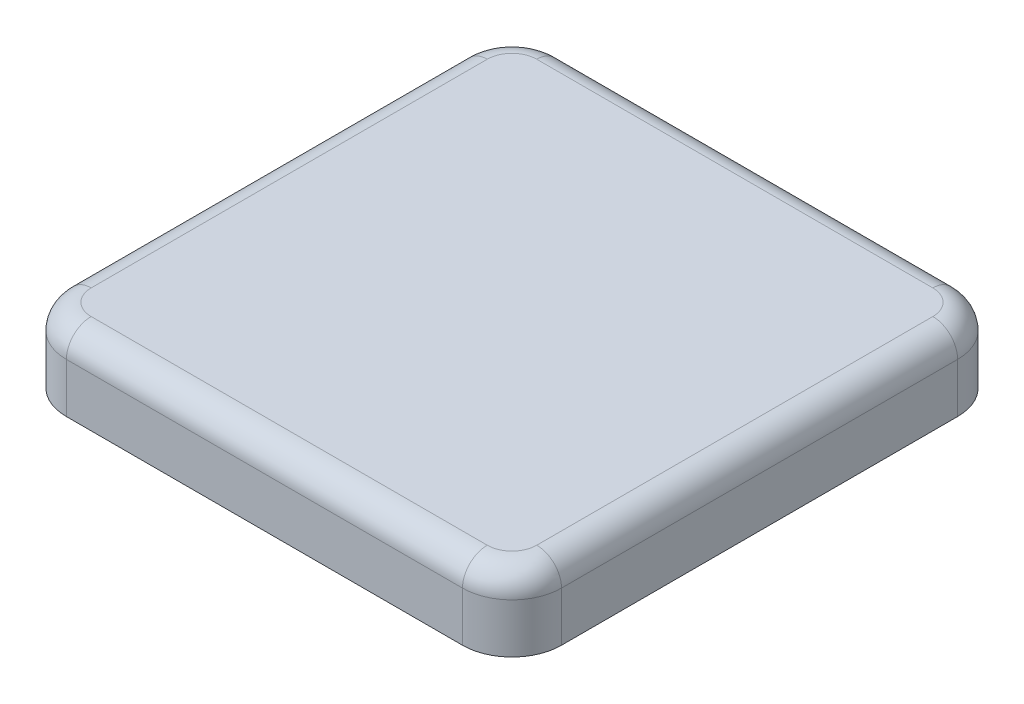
SolidWorks part; units mm, degrees
ref_plane "正面" through (0, 0, 0) normal (0, 0, 1) x (1, 0, 0)
ref_plane "平面" through (0, 0, 0) normal (0, 1, 0) x (1, 0, 0)
ref_plane "右側面" through (0, 0, 0) normal (1, 0, 0) x (0, 0, -1)
sketch "ｽｹｯﾁ1" plane through (0, 0, 0) normal (0, 1, 0) x (0, 0, -1)
  line L1 (-8, 10) -> (8, 10)
  line L2 (-10, 8) -> (-10, -8)
  line L3 (-8, -10) -> (8, -10)
  line L4 (10, 8) -> (10, -8)
  arc A0 (10, 8) -> (8, 10) centre (8, 8) ccw
  arc A1 (8, -10) -> (10, -8) centre (8, -8) ccw
  arc A2 (-10, -8) -> (-8, -10) centre (-8, -8) ccw
  arc A3 (-8, 10) -> (-10, 8) centre (-8, 8) ccw
  point P7 (10, 10)
  point P10 (10, -10)
  point P15 (-10, 10)
  dimension "D5" = 2
  dimension "D1" = 10
  dimension "D2" = 20
  dimension "D3" = 10
  dimension "D4" = 20
extrude "押し出し1" add sketch "ｽｹｯﾁ1" along normal mid plane 3
fillet "ﾌｨﾚｯﾄ1" radius 1 8 edges at (-9.4142, 1.5, 9.4142) (-10, 1.5, 0) (-9.4142, 1.5, -9.4142) (0, 1.5, -10) (9.4142, 1.5, -9.4142) (10, 1.5, 0) (9.4142, 1.5, 9.4142) (0, 1.5, 10)
sketch "ｽｹｯﾁ2" plane through (0, -1.5, 0) normal (0, -1, 0) x (1, 0, 0)
  line L1 (-8, 8.8) -> (8, 8.8)
  line L2 (-8.8, 8) -> (-8.8, -8)
  line L3 (-8, -8.8) -> (8, -8.8)
  line L4 (8.8, 8) -> (8.8, -8)
  arc A0 (-8, 8.8) -> (-8.8, 8) centre (-8, 8) ccw
  arc A1 (8.8, 8) -> (8, 8.8) centre (8, 8) ccw
  arc A2 (8, -8.8) -> (8.8, -8) centre (8, -8) ccw
  arc A3 (-8.8, -8) -> (-8, -8.8) centre (-8, -8) ccw
  point P7 (-8.8, 8.8)
  point P10 (8.8, 8.8)
  point P13 (8.8, -8.8)
  dimension "D5" = 0.8
  dimension "D1" = 8.8
  dimension "D2" = 17.6
  dimension "D3" = 8.8
  dimension "D4" = 17.6
extrude "押し出し2" cut sketch "ｽｹｯﾁ2" against normal blind 1
sketch "ｽｹｯﾁ3" plane through (0, -0.5, 0) normal (0, -1, 0) x (1, 0, 0)
  line L0 (-8.8, 8) -> (-8.8, -8) construction
  line L1 (-8.8, 2.5) -> (-7.8, 2.5)
  line L2 (-8.8, 2.5) -> (-8.8, -2.5)
  line L3 (-8.8, -2.5) -> (-7.8, -2.5)
  line L4 (-7.8, 2.5) -> (-7.8, -2.5)
  line L5 (8, -10) -> (-8, -10) construction
  dimension "D1" = 5
  dimension "D2" = 1
  dimension "D3" = 1
  dimension "D4" = 7.5
extrude "押し出し3" add sketch "ｽｹｯﾁ3" along normal blind 2
sketch "ｽｹｯﾁ4" plane through (0, -0.5, 0) normal (0, -1, 0) x (1, 0, 0)
  line L1 (-1.2, 2.1) -> (1.2, 2.1)
  line L2 (-1.2, 2.1) -> (-1.2, -2.1)
  line L3 (-1.2, -2.1) -> (1.2, -2.1)
  line L4 (1.2, 2.1) -> (1.2, -2.1)
  dimension "D1" = 2.4
  dimension "D2" = 4.2
  dimension "D3" = 1.2
  dimension "D4" = 2.1
extrude "押し出し4" add sketch "ｽｹｯﾁ4" along normal blind 7
fillet "ﾌｨﾚｯﾄ2" radius 1 4 edges at (0, -7.5, 2.1) (1.2, -7.5, 0) (0, -7.5, -2.1) (-1.2, -7.5, 0)
